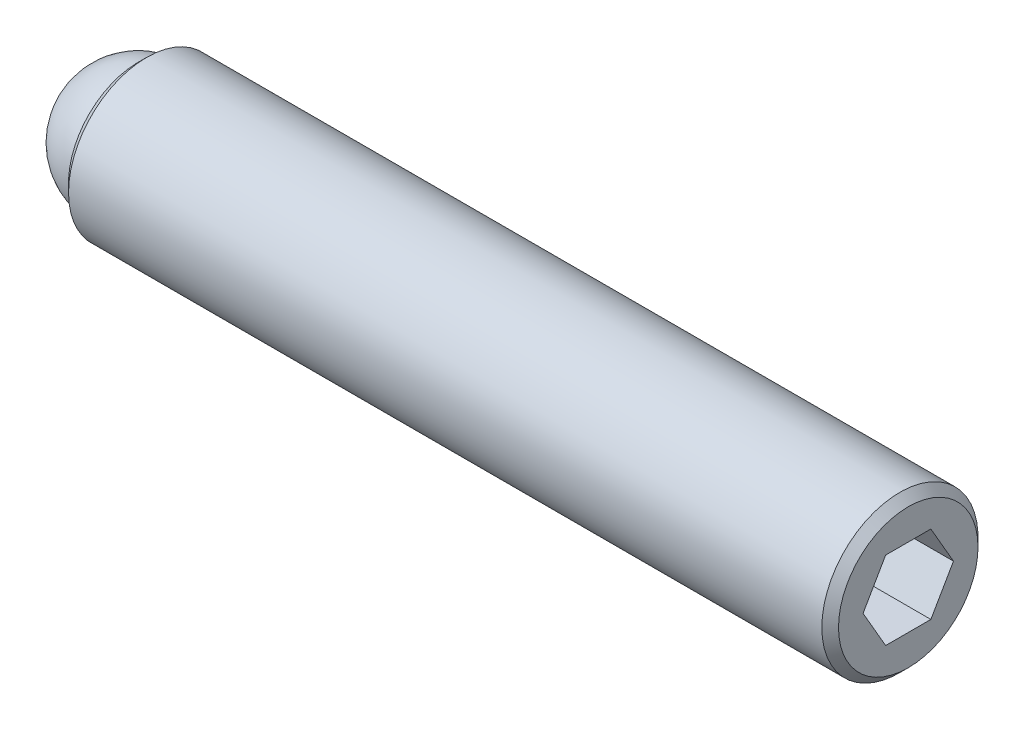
SolidWorks part; units mm, degrees
ref_plane "Front Plane" through (0, 0, 0) normal (0, 0, 1) x (1, 0, 0)
ref_plane "Top Plane" through (0, 0, 0) normal (0, 1, 0) x (1, 0, 0)
ref_plane "Right Plane" through (0, 0, 0) normal (1, 0, 0) x (0, 0, -1)
sketch "Sketch2" plane through (0, 0, 0) normal (1, 0, 0) x (0, 0, -1)
  circle A0 centre (0, 0) radius 2.3749
  dimension "D1" = 4.7498
extrude "Boss-Extrude1" add sketch "Sketch2" along normal blind 23.4156
sketch "Sketch3" plane through (0, 0, 0) normal (-1, 0, 0) x (0, 0, 1)
  circle A0 centre (0, 0) radius 1.9812
  dimension "D1" = 3.9624
chamfer "Chamfer1" distance 0.254 angle 45 1 edges at (0, 0, -2.3749)
chamfer "Chamfer2" distance 0.254 angle 45 1 edges at (23.4156, 0, -2.3749)
sketch "Sketch4" plane through (23.4156, 0, 0) normal (1, 0, 0) x (0, 0, -1)
  line L1 (1.3748, 0) -> (0.6874, 1.1906)
  line L2 (0.6874, 1.1906) -> (-0.6874, 1.1906)
  line L3 (-0.6874, 1.1906) -> (-1.3748, 0)
  line L4 (-1.3748, 0) -> (-0.6874, -1.1906)
  line L5 (-0.6874, -1.1906) -> (0.6874, -1.1906)
  line L6 (0.6874, -1.1906) -> (1.3748, 0)
  circle A0 centre (0, 0) radius 1.1906 construction
  dimension "D1" = 2.3813
extrude "Cut-Extrude2" cut sketch "Sketch4" against normal blind 2.286
extrude "Cut-Extrude3" cut sketch "Sketch3" against normal blind 1.9844
sketch "Sketch5" plane through (0, 0, 0) normal (-1, 0, 0) x (0, 0, 1)
  line L0 (0, 0) -> (0, -1.9844)
  line L1 (0, 0) -> (0, 1.9844)
  arc A0 (0, 1.9844) -> (0, -1.9844) centre (0, 0) ccw
  dimension "D1" = 1.9844
revolve "Revolve1" add sketch "Sketch5" angle 360 about L1
